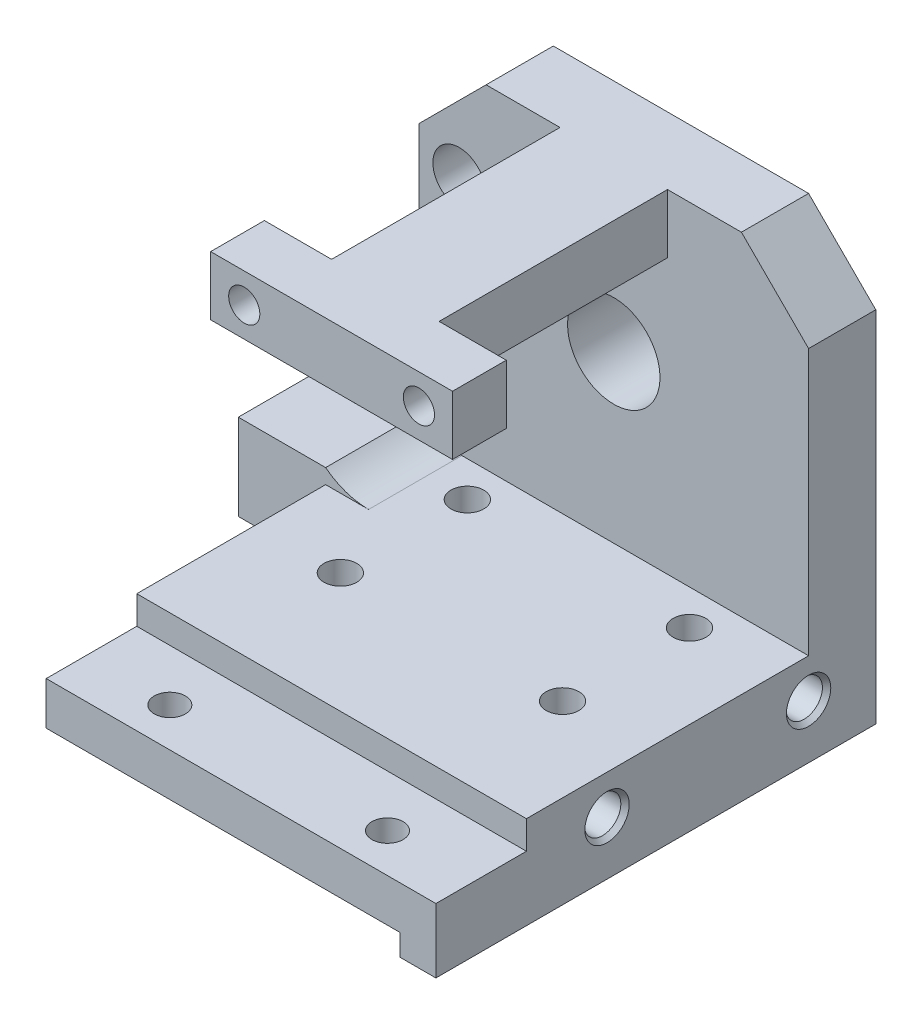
SolidWorks part; units mm, degrees
ref_plane "Front" through (0, 0, 0) normal (0, 0, 1) x (1, 0, 0)
ref_plane "Top" through (0, 0, 0) normal (0, 1, 0) x (1, 0, 0)
ref_plane "Right" through (0, 0, 0) normal (1, 0, 0) x (0, 0, -1)
sketch "Sketch1" plane through (0, 0, 0) normal (0, 0, 1) x (1, 0, 0)
  line L1 (-18.415, 15.748) -> (18.415, 15.748)
  line L2 (-18.415, 15.748) -> (-18.415, -22.479)
  line L3 (-18.415, -22.479) -> (18.415, -22.479)
  line L4 (18.415, 15.748) -> (18.415, -22.479)
  point P4 (0, -22.479)
  dimension "D1" = 36.83
  dimension "D2" = 38.227
  dimension "D3" = 22.479
extrude "Extrude1" add sketch "Sketch1" along normal blind 6.35
sketch "Sketch7" plane through (0, 0, 0) normal (0, 0, -1) x (-1, 0, 0)
  line L0 (18.415, 15.748) -> (18.415, -22.479) construction
  line L3 (-18.415, 15.748) -> (18.415, 15.748) construction
  circle A0 centre (14.605, 6.858) radius 2.4892
  dimension "D1" = 4.9784
  dimension "D2" = 3.81
  dimension "D3" = 8.89
extrude "Cut-Extrude1" cut sketch "Sketch7" against normal through all
sketch "Sketch8" plane through (0, 0, 0) normal (0, 0, -1) x (-1, 0, 0)
  line L0 (-18.415, -22.479) -> (-18.415, 15.748) construction
  line L1 (-18.415, -20.447) -> (18.415, -20.447) construction
  line L2 (18.415, 15.748) -> (18.415, -22.479) construction
  line L3 (18.415, -22.479) -> (-18.415, -22.479) construction
  circle A0 centre (-1.9685, -3.0644) radius 10.795
  circle A1 centre (-1.9685, -3.0644) radius 14.2875 construction
  circle A2 centre (14.605, 6.858) radius 2.4892 construction
  dimension "D1" = 21.59
  dimension "D2" = 28.575
  dimension "D3" = 2.159
  dimension "D4" = 2.54
  dimension "D5" = 2.032
  dimension "D6" = 3.0951
extrude "Extrude3" add sketch "Sketch8" along normal blind 1.524
sketch "Sketch11" plane through (0, 0, 6.35) normal (0, 0, 1) x (1, 0, 0)
  circle A0 centre (18.415, 15.748) radius 9.525
  dimension "D1" = 19.05
extrude "Cut-Extrude2" [suppressed] cut sketch "Sketch11" against normal through all
chamfer "Chamfer1" [suppressed] distance 2.032 angle 45
sketch "Sketch12" plane through (0, 0, -1.524) normal (0, 0, -1) x (-1, 0, 0)
  circle A0 centre (0, 0) radius 4.3688
  dimension "D1" = 8.7376
extrude "Cut-Extrude3" cut sketch "Sketch12" against normal through all
sketch "Sketch13" plane through (0, 0, 6.35) normal (0, 0, 1) x (1, 0, 0)
  line L0 (18.415, -22.479) -> (18.415, 15.748) construction
  line L1 (-18.415, -22.479) -> (18.415, -22.479)
  line L2 (-18.415, -22.479) -> (-18.415, -15.748)
  line L3 (-18.415, -15.748) -> (18.415, -15.748)
  line L4 (18.415, -22.479) -> (18.415, -15.748)
  dimension "D1" = 6.731
extrude "Extrude4" add sketch "Sketch13" along normal blind 36.83
sketch "Sketch14" plane through (-18.415, 0, 0) normal (-1, 0, 0) x (0, 0, 1)
  line L0 (43.18, -22.479) -> (0, -22.479) construction
  line L1 (43.18, -15.748) -> (33.02, -15.748)
  line L2 (43.18, -15.748) -> (43.18, -18.415)
  line L3 (43.18, -18.415) -> (33.02, -18.415)
  line L4 (33.02, -15.748) -> (33.02, -18.415)
  dimension "D1" = 4.064
  dimension "D2" = 10.16
extrude "Cut-Extrude4" cut sketch "Sketch14" against normal through all
sketch "Sketch16" plane through (0, -22.479, 0) normal (0, -1, 0) x (1, 0, 0)
  line L0 (-18.415, 43.18) -> (18.415, 43.18) construction
  line L1 (18.415, 0) -> (15, 0)
  line L2 (18.415, 0) -> (18.415, 43.18)
  line L3 (18.415, 43.18) -> (15, 43.18)
  line L4 (15, 0) -> (15, 43.18)
  line L6 (-18.415, 0) -> (-15, 0)
  line L7 (-18.415, 0) -> (-18.415, 43.18)
  line L8 (-18.415, 43.18) -> (-15, 43.18)
  line L9 (-15, 0) -> (-15, 43.18)
  dimension "D1" = 3.415
  dimension "D2" = 3.415
extrude "Extrude5" add sketch "Sketch16" along normal blind 2.032
sketch "Sketch17" plane through (0, 0, 6.35) normal (0, 0, 1) x (1, 0, 0)
  line L0 (18.415, 15.748) -> (-18.415, 15.748) construction
  line L1 (-5.08, 15.748) -> (5.08, 15.748)
  line L2 (-5.08, 15.748) -> (-5.08, 10.16)
  line L3 (-5.08, 10.16) -> (5.08, 10.16)
  line L4 (5.08, 15.748) -> (5.08, 10.16)
  point P6 (0, 10.16)
  dimension "D1" = 5.588
  dimension "D2" = 10.16
extrude "Extrude6" add sketch "Sketch17" along normal up to surface (26.67 mm away)
sketch "Sketch18" plane through (-5.08, 0, 0) normal (-1, 0, 0) x (0, 0, 1)
  line L0 (33.02, 10.16) -> (6.35, 10.16) construction
  line L1 (33.02, 15.748) -> (27.94, 15.748)
  line L2 (33.02, 15.748) -> (33.02, 10.16)
  line L3 (33.02, 10.16) -> (27.94, 10.16)
  line L4 (27.94, 15.748) -> (27.94, 10.16)
  dimension "D1" = 5.08
extrude "Extrude7" add sketch "Sketch18" along normal blind 6.35
mirror "Mirror1" about plane through (0, 0, 0) normal (1, 0, 0) of "Extrude7"
hole_wizard "#32 (0.116000) Diameter Hole1" positions "Sketch20" profile "Sketch19" hole size "#32" standard "Ansi Inch"
sketch "Sketch20" plane through (0, 0, 27.94) normal (0, 0, -1) x (-1, 0, 0)
  line L2 (11.43, 10.16) -> (5.08, 15.748) construction
  point P0 (8.255, 12.954)
sketch "Sketch19" plane through (-8.255, 12.954, 27.94) normal (1, 0, 0) x (0, 1, 0)
  line L0 (0, 0) -> (0, 26.2852)
  line L1 (0, 26.2852) -> (1.4732, 25.4)
  line L2 (1.4732, 25.4) -> (1.4732, 0)
  line L5 (1.4732, 0) -> (0, 0)
  line L10 (0, 26.2852) -> (-1.4732, 25.4) construction
  line L11 (0, -6.35) -> (0, 107.95) construction
  dimension "Hole Dia." = 2.9464
  dimension "Hole Depth" = 25.4
  dimension "Drill Angle" = 118
mirror "Mirror2" about plane through (0, 0, 0) normal (1, 0, 0) of "#32 (0.116000) Diameter Hole1"
chamfer "Chamfer2" distance 6.35 angle 45 2 edges at (18.415, 15.748, 3.175) (-18.415, 15.748, 3.175)
sketch "Sketch21" plane through (-15, 0, 0) normal (1, 0, 0) x (0, 0, -1)
  line L1 (0, -22.479) -> (-43.18, -22.479)
  line L2 (0, -22.479) -> (0, -24.511)
  line L3 (0, -24.511) -> (-43.18, -24.511)
  line L4 (-43.18, -22.479) -> (-43.18, -24.511)
extrude "Cut-Extrude5" cut sketch "Sketch21" against normal through all
hole_wizard "#32 (0.116000) Diameter Hole2" positions "Sketch23" profile "Sketch22" hole size "#32" standard "Ansi Inch"
sketch "Sketch23" plane through (0, -22.479, 0) normal (0, -1, 0) x (1, 0, 0)
  line L0 (18.415, 0) -> (18.415, 43.18) construction
  line L1 (-18.415, 0) -> (15, 0) construction
  point P0 (10.16, 37.8944)
  point P1 (-10.414, 37.8944)
  dimension "D1" = 28.829
  dimension "D2" = 8.255
  dimension "D3" = 37.8944
  dimension "D4" = 37.8944
sketch "Sketch22" plane through (10.16, -22.479, 37.8944) normal (1, 0, 0) x (0, 0, -1)
  line L0 (0, 0) -> (0, 38.227)
  line L1 (0, 38.227) -> (1.4732, 38.227)
  line L2 (1.4732, 38.227) -> (1.4732, 0)
  line L5 (1.4732, 0) -> (0, 0)
  line L11 (0, -6.35) -> (0, 107.95) construction
  dimension "Thru Hole Dia." = 2.9464
  dimension "Thru Hole Depth" = 38.227
hole_wizard "M3.1 (3.100000) Diameter Hole1" positions "Sketch25" profile "Sketch24" hole size "M3.1" standard "Ansi Metric"
sketch "Sketch25" plane through (0, -15.748, 0) normal (0, 1, 0) x (-1, 0, 0)
  line L0 (-12.065, 0) -> (-18.415, 0) construction
  line L1 (18.415, 0) -> (12.065, 0) construction
  line L2 (-15, 0) -> (-18.415, 0) construction
  point P0 (-10.5, 9.69)
  point P1 (10.5, 9.69)
  point P2 (10.5, 21.69)
  point P3 (-10.5, 21.69)
  point P20 (15.24, 0)
  point P21 (-16.7075, 0)
  dimension "D1" = 9.69
  dimension "D2" = 9.69
  dimension "D3" = 21.69
  dimension "D4" = 21.69
  dimension "D5" = 10.5
  dimension "D6" = 10.5
  dimension "D7" = 10.5
  dimension "D8" = 10.5
sketch "Sketch24" plane through (10.5, -15.748, 9.69) normal (1, 0, 0) x (0, 0, 1)
  line L0 (0, 0) -> (0, 8.763)
  line L1 (0, 8.763) -> (1.55, 8.763)
  line L2 (1.55, 8.763) -> (1.55, 0)
  line L5 (1.55, 0) -> (0, 0)
  line L11 (0, -6.35) -> (0, 107.95) construction
  dimension "Thru Hole Dia." = 3.1
  dimension "Thru Hole Depth" = 8.763
sketch "Sketch26" plane through (0, 15.748, 0) normal (0, 1, 0) x (-1, 0, 0)
  line L1 (5.08, 6.35) -> (-5.08, 6.35)
  line L2 (5.08, 6.35) -> (5.08, 27.94)
  line L3 (5.08, 27.94) -> (-5.08, 27.94)
  line L4 (-5.08, 6.35) -> (-5.08, 27.94)
extrude "Cut-Extrude6" [suppressed] cut sketch "Sketch26" against normal blind 0.889
sketch "Sketch27" plane through (0, 0, 43.18) normal (0, 0, 1) x (1, 0, 0)
  line L1 (-18.415, -18.415) -> (18.415, -18.415)
  line L2 (-18.415, -18.415) -> (-18.415, -24.511)
  line L3 (-18.415, -24.511) -> (18.415, -24.511)
  line L4 (18.415, -18.415) -> (18.415, -24.511)
extrude "Cut-Extrude7" cut sketch "Sketch27" against normal offset from surface (1.6026 mm away) 8.5574
sketch "Sketch28" plane through (0, 15.748, 0) normal (0, 1, 0) x (-1, 0, 0)
  line L1 (-11.43, 33.02) -> (11.43, 33.02)
  line L2 (-11.43, 33.02) -> (-11.43, 27.94)
  line L3 (-11.43, 27.94) -> (11.43, 27.94)
  line L4 (11.43, 33.02) -> (11.43, 27.94)
extrude "Cut-Extrude8" [suppressed] cut sketch "Sketch28" against normal up to surface (0.889 mm away)
ref_plane "ball mount" through (0, -19.1135, 0) normal (0, -1, 0) x (1, 0, 0)
sketch "Sketch29" plane through (-18.415, 0, 0) normal (-1, 0, 0) x (0, 0, 1)
  line L0 (6.35, 9.398) -> (6.35, -15.748) construction
  line L1 (0, -22.479) -> (15.1678, -22.479)
  line L2 (0, -22.479) -> (0, -14.351)
  line L3 (0, -14.351) -> (6.35, -14.351)
  line L4 (6.35, -15.748) -> (6.35, -14.351)
  line L5 (6.35, -15.748) -> (15.1678, -15.748)
  line L6 (33.02, -15.748) -> (6.35, -15.748) construction
  line L7 (15.1678, -15.748) -> (15.1678, -22.479)
  dimension "D1" = 8.128
extrude "Extrude8" add sketch "Sketch29" along normal blind 8.255
chamfer "Chamfer3" distance 4.318 angle 60 1 edges at (-26.67, -18.415, 0)
hole_wizard "1/4-20 Tapped Hole1" positions "Sketch31" profile "Sketch30" tap size "1/4-20" standard "Ansi Inch"
sketch "Sketch31" plane through (-4.7978, 0, -8.3099) normal (-0.5, 0, -0.866) x (-0.866, 0, 0.5)
  line L0 (16.6199, -14.351) -> (25.2559, -22.479) construction
  point P0 (20.9379, -18.415)
sketch "Sketch30" plane through (-22.9305, -18.415, 2.159) normal (0, 1, 0) x (-0.866, 0, 0.5)
  line L0 (0, 0) -> (0, 11.43)
  line L1 (0, 11.43) -> (2.5527, 11.43)
  line L2 (2.5527, 11.43) -> (2.5527, 0)
  line L5 (2.5527, 0) -> (0, 0)
  line L10 (0, 11.43) -> (-2.5527, 11.43) construction
  line L11 (0, -6.35) -> (0, 107.95) construction
  dimension "Tap Drill Dia." = 5.1054
  dimension "Tap Drill Depth" = 11.43
  dimension "Drill Angle" = 180
sketch "Sketch32" plane through (0, -15.748, 0) normal (0, 1, 0) x (-1, 0, 0)
  line L1 (26.67, 6.35) -> (18.415, 6.35)
  line L2 (26.67, 6.35) -> (26.67, 15.1678)
  line L3 (26.67, 15.1678) -> (18.415, 15.1678)
  line L4 (18.415, 6.35) -> (18.415, 15.1678)
extrude "Extrude9" add sketch "Sketch32" along normal up to surface (1.397 mm away)
fillet "Fillet1" radius 6.604 1 edges
fillet "Fillet2" radius 3.556 2 edges
hole_wizard "M4x0.7 Tapped Hole1" positions "Sketch34" profile "Sketch33" tap size "M4x0.7" standard "Ansi Metric"
sketch "Sketch34" plane through (13.9065, 13.9065, 0) normal (0.7071, 0.7071, 0) x (0, 0, -1)
  line L0 (0, 2.6043) -> (-6.35, -6.376) construction
  point P0 (-3.175, -1.8859)
sketch "Sketch33" plane through (15.24, 12.573, 3.175) normal (0, 0, 1) x (-0.7071, 0.7071, 0)
  line L0 (0, 0) -> (0, 10.1)
  line L1 (0, 10.1) -> (1.65, 10.1)
  line L2 (1.65, 10.1) -> (1.65, 0)
  line L5 (1.65, 0) -> (0, 0)
  line L10 (0, 10.1) -> (-1.65, 10.1) construction
  line L11 (0, -6.35) -> (0, 107.95) construction
  dimension "Tap Drill Dia." = 3.3
  dimension "Tap Drill Depth" = 10.1
  dimension "Drill Angle" = 180
sketch "Sketch35" [suppressed] plane through (0, -15.748, 0) normal (0, 1, 0) x (-1, 0, 0)
  line L0 (-10.5, 9.69) -> (-10.5, 21.69) construction
  point P4 (-10.5, 15.69)
sketch "Sketch36" plane through (18.415, 0, 0) normal (1, 0, 0) x (0, 0, -1)
  line L0 (0, -24.511) -> (0, 9.398) construction
  line L1 (0, -24.511) -> (-41.5774, -24.511) construction
  point P0 (-6.35, -19.431)
  point P1 (-25.4, -19.431)
  dimension "D1" = 6.35
  dimension "D2" = 19.05
  dimension "D3" = 5.08
  dimension "D4" = 5.08
hole_wizard "#8-32 Tapped Hole2" positions "3DSketch2" profile "Sketch38" tap size "#8-32" standard "Ansi Inch"
sketch3d "3DSketch2"
  point P0 (18.415, -19.431, 6.35)
  point P3 (18.415, -19.431, 25.4)
sketch "Sketch38" plane through (18.415, -19.431, 6.35) normal (0, 1, 0) x (0, 0, -1)
  line L0 (0, 0) -> (0, 10.7188)
  line L1 (0, 10.7188) -> (1.7272, 10.7188)
  line L2 (1.7272, 10.7188) -> (1.7272, 0.4237)
  line L3 (1.7272, 0.4237) -> (2.0955, 0)
  line L5 (2.0955, 0) -> (0, 0)
  line L6 (-1.7272, 0.4237) -> (-2.0955, 0) construction
  line L10 (0, 10.7188) -> (-1.7272, 10.7188) construction
  line L11 (0, -6.35) -> (0, 107.95) construction
  dimension "Tap Drill Dia." = 3.4544
  dimension "Tap Drill Depth" = 10.7188
  dimension "Near C'Sink Dia." = 4.191
  dimension "Near C'Sink Angle" = 82
  dimension "Drill Angle" = 180
